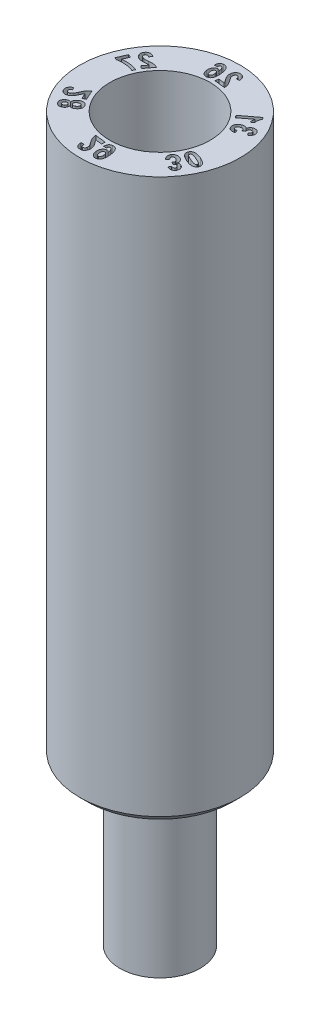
SolidWorks part; units mm, degrees
other "<M2L6-SetScrew>-<Chamfer1>" parameters "D10"=0.19
ref_plane "Front Plane" through (0, 0, 0) normal (0, 0, 1) x (1, 0, 0)
ref_plane "Top Plane" through (0, 0, 0) normal (0, 1, 0) x (1, 0, 0)
ref_plane "Right Plane" through (0, 0, 0) normal (1, 0, 0) x (0, 0, -1)
sketch "Sketch1" plane through (0, 0, 0) normal (0, 0, 1) x (1, 0, 0)
  line L0 (0, 0) -> (0, 20) construction
  line L1 (0, -2.2) -> (0, 2.2) construction
  line L2 (1, -14) -> (1.81, -14)
  line L4 (2, -13.81) -> (2, 0)
  line L5 (2, 0) -> (1.25, 0)
  line L6 (1.25, 0) -> (1.25, -2.3)
  line L7 (1.25, -2.3) -> (0.7, -2.3)
  line L8 (0.7, -2.3) -> (0.7, -10.5)
  line L9 (0.7, -10.5) -> (1, -10.5)
  line L10 (1, -10.5) -> (1, -14)
  line L11 (1.81, -14) -> (2, -13.81)
  point P6 (2, -14)
  dimension "D1" = 2.3
  dimension "D2" = 3.5
  dimension "D3" = 1.4
  dimension "D4" = 2.5
  dimension "D5" = 4
  dimension "D6" = 2
  dimension "D7" = 14
revolve "Revolve1" add sketch "Sketch1" angle 360 about L0
sketch "Sketch2" plane through (0, 0, 0) normal (0, 1, 0) x (1, 0, 0)
  line L0 (0, 0) -> (0, 2.1482) construction
  line L1 (0, 0) -> (1.8604, 1.0741) construction
  line L2 (0, 0) -> (-2.2122, -1.2772) construction
  line L3 (0, 0) -> (0, -2.1482) construction
  line L4 (0, 0) -> (2.199, -1.2696) construction
  line L5 (0, 0) -> (-1.8604, 1.0741) construction
  line L129 (0, 0) -> (1.8604, -1.0741) construction
  line L130 (0, 0) -> (-1.8604, -1.0741) construction
  arc A0 (0.302, 1.3158) -> (0.7719, 1.1076) centre (0, 0) ccw construction
  text T0 "26     27     28     29     30     31" font "Arial Narrow" height 0.48
  dimension "D1" = 2.7
  dimension "D2" = 6
extrude "Cut-Extrude1" cut sketch "Sketch2" against normal blind 0.2
inserted part "M2L6-SetScrew"
move or copy body "Body-Move/Copy2" placed by mates yes
other "Distance1" parameters "D1"=4
